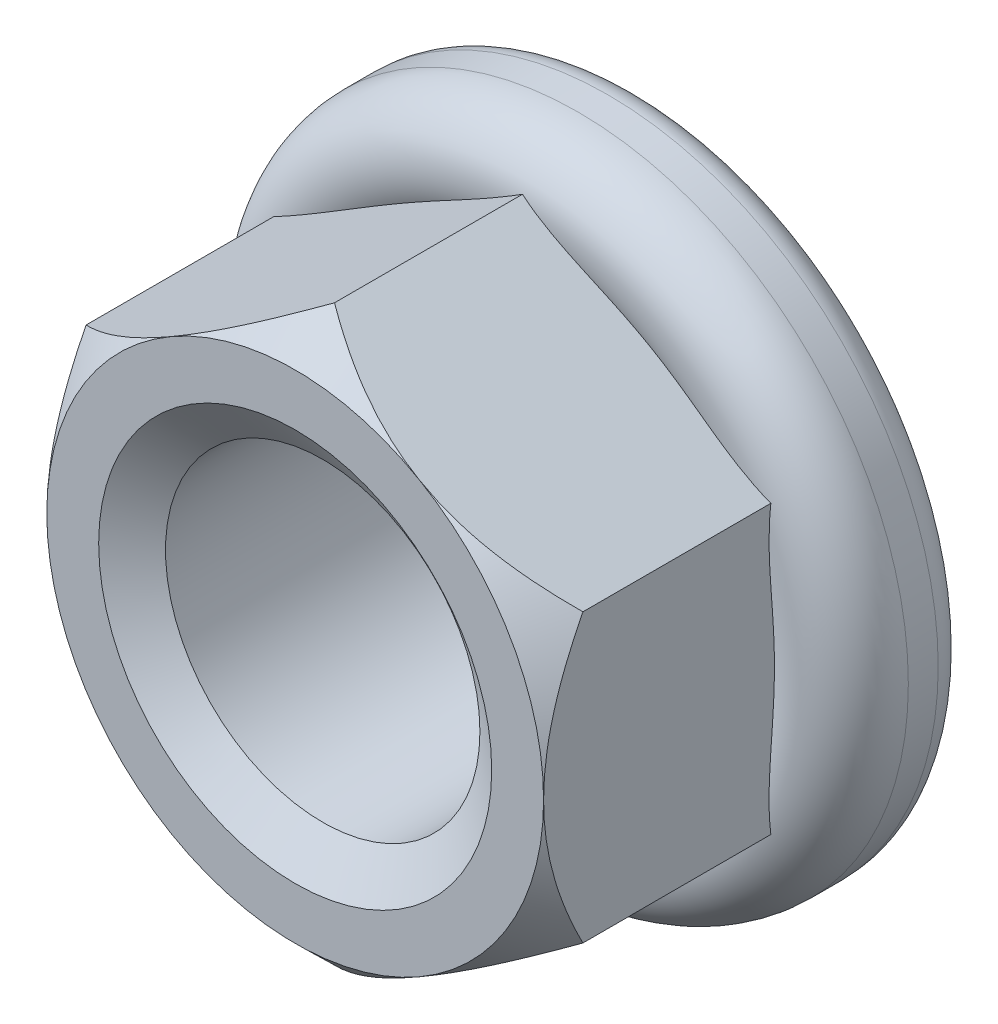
SolidWorks part; units mm, degrees
ref_plane "Plane1" through (0, 0, 0) normal (0, 0, 1) x (1, 0, 0)
ref_plane "Plane2" through (0, 0, 0) normal (0, 1, 0) x (1, 0, 0)
ref_plane "Plane3" through (0, 0, 0) normal (1, 0, 0) x (0, 0, -1)
sketch "BaseNutSke" plane through (0, 0, 0) normal (0, 0, 1) x (1, 0, 0)
  line L6 (4.0132, 2.317) -> (4.0132, -2.317)
  line L7 (-4.0132, 2.317) -> (-4.0132, -2.317)
  line L8 (4.0132, 2.317) -> (0, 4.634)
  line L9 (0, 4.634) -> (-4.0132, 2.317)
  line L10 (-4.0132, -2.317) -> (0, -4.634)
  line L11 (0, -4.634) -> (4.0132, -2.317)
  circle A0 centre (0, 0) radius 2.54
  dimension "D4" = 4.0132
  dimension "Thread_min" = 5.08
  dimension "D1" = 120
  dimension "D2" = 4.0132
  dimension "D3" = 4.0132
  dimension "Width_flats" = 8.0264
extrude "BaseNut" add sketch "BaseNutSke" against normal blind 5.5626
sketch "Sketch4" plane through (0, 0, 0) normal (1, 0, 0) x (0, 0, -1)
  line L0 (5.5626, 4.0132) -> (5.1562, 4.0132)
  line L1 (5.5626, 4.0132) -> (5.5626, 17.334)
  line L2 (5.1562, 17.334) -> (5.5626, 17.334)
  line L3 (5.1562, 17.334) -> (5.1562, 4.0132)
  line L4 (0, 0) -> (34.925, 0) construction
  line L6 (5.5626, 2.317) -> (5.5626, 4.634) construction
  line L7 (0, 4.0132) -> (-12.7, 4.0132)
  line L8 (0, 2.317) -> (0, 4.634) construction
  line L9 (0.635, 4.634) -> (0.635, 17.334)
  line L10 (0.635, 17.334) -> (-12.7, 17.334)
  line L11 (-12.7, 17.334) -> (-12.7, 4.0132)
  line L12 (0, 4.0132) -> (0.635, 4.634)
  line L14 (0, 2.317) -> (0, -2.317) construction
  line L15 (5.5626, 4.634) -> (0, 4.634) construction
  dimension "D1" = 4.0132
  dimension "D2" = 0.635
  dimension "Bearing_ht" = 0.4064
  dimension "D3" = 12.7
  dimension "D4" = 12.7
revolve "Bearing-Face" [suppressed] cut sketch "Sketch4" angle 360 about L4
sketch "Sketch3" plane through (0, 0, 0) normal (1, 0, 0) x (0, 0, -1)
  line L0 (5.5626, 4.0132) -> (4.9276, 4.634) construction
  line L1 (4.9276, 4.634) -> (4.9276, 17.334) construction
  line L2 (4.9276, 17.334) -> (18.2626, 17.334) construction
  line L3 (18.2626, 17.334) -> (18.2626, 4.0132) construction
  line L4 (18.2626, 4.0132) -> (5.5626, 4.0132) construction
  line L5 (5.5626, 2.317) -> (5.5626, 4.634) construction
  line L6 (5.5626, 4.634) -> (0, 4.634) construction
  line L7 (0, 0) -> (38.6776, 0) construction
  line L8 (5.5626, 0) -> (0, 0) construction
  line L9 (2.7813, 4.634) -> (2.7813, 44.222) construction
  line L10 (0.635, 17.334) -> (-12.7, 17.334)
  line L11 (-12.7, 17.334) -> (-12.7, 4.0132)
  line L12 (-12.7, 4.0132) -> (0, 4.0132)
  line L13 (0, 4.0132) -> (0.635, 4.634)
  line L14 (0.635, 4.634) -> (0.635, 17.334)
  line L16 (5.5626, 4.634) -> (0, 4.634) construction
  dimension "D1" = 4.0132
  dimension "D2" = 0.635
  dimension "D3" = 12.7
  dimension "D4" = 12.7
revolve "Double-Chamfer" cut sketch "Sketch3" angle 360 about L7
sketch "EndChamferSke" plane through (0, 0, 0) normal (1, 0, 0) x (0, 0, -1)
  line L0 (5.5372, 3.175) -> (5.0481, 2.4765)
  line L1 (5.588, 3.175) -> (5.5372, 3.175)
  line L2 (5.588, 3.175) -> (5.588, 2.4765)
  line L3 (5.588, 2.4765) -> (5.0481, 2.4765)
  line L6 (-0.0508, 3.175) -> (0, 3.175)
  line L7 (0, 3.175) -> (0.4891, 2.4765)
  line L9 (0.4891, 2.4765) -> (-0.0508, 2.4765)
  line L10 (-0.0508, 2.4765) -> (-0.0508, 3.175)
  line L11 (25.0375, 0) -> (38.388, 0) construction
  dimension "D1" = 35
  dimension "D2" = 0.0508
  dimension "Offset1" = 5.588
  dimension "ThreadMajor" = 3.175
  dimension "ChamferDepth" = 0.6985
  dimension "Offset2" = 5.6388
sketch "ThdSchSke" plane through (0, 0, 0) normal (0, 1, 0) x (1, 0, 0)
  line L0 (-3.175, 0.0254) -> (-2.54, 0.47)
  line L1 (-2.54, 0.47) -> (-1.27, 0.47)
  line L2 (-1.27, 0.47) -> (-1.27, -0.4192)
  line L3 (-1.27, -0.4192) -> (-2.54, -0.4192)
  line L4 (-2.54, -0.4192) -> (-3.175, 0.0254)
  line L6 (0, 0.4788) -> (0, -2.9874) construction
  line L7 (3.175, 0.4788) -> (15.875, 0.4788) construction
  dimension "D1" = 0.0254
  dimension "VeeAngle" = 70
  dimension "SideAngle" = 55
  dimension "OverCut" = 2.54
  dimension "Advance" = 0.9068
  dimension "Thread_major" = 6.35
  dimension "Tap_drill" = 5.08
revolve "EndChamfer" cut sketch "EndChamferSke" angle 360 about L11
revolve "ThreadSchematic" [suppressed] cut sketch "ThdSchSke" angle 360 about L6
pattern_linear "ThdSchPat" [suppressed]
sketch "Sketch5" plane through (0, 0, 0) normal (1, 0, 0) x (0, 0, -1)
  line L0 (5.5626, 3.4755) -> (5.5626, 4.826)
  line L1 (5.0546, 5.334) -> (4.572, 5.334)
  line L2 (4.572, 3.4755) -> (5.5626, 3.4755)
  line L3 (-4.4998, 0) -> (10.8386, 0) construction
  line L4 (5.5626, 4.634) -> (5.5626, 2.317) construction
  line L8 (5.5626, 2.317) -> (5.5626, 4.634) construction
  arc A0 (4.572, 5.334) -> (4.572, 3.4755) centre (4.572, 4.4048) ccw
  arc A1 (5.5626, 4.826) -> (5.0546, 5.334) centre (5.0546, 4.826) ccw
  dimension "A_dia" = 10.668
  dimension "B_dia" = 9.652
  dimension "J" = 0.4826
revolve "Revolve1" add sketch "Sketch5" angle 360 about L3
equation "\"D2@BaseNutSke\" = \"Width_flats@BaseNutSke\" / 2"
equation "\"D3@BaseNutSke\" = \"Width_flats@BaseNutSke\" / 2"
equation "\"D1@Sketch3\" = \"Width_flats@BaseNutSke\" /2"
equation "\"D2@Sketch3\" = \"Thread_major@ThreadCosmetic\" *.1"
equation "\"D1@Sketch4\" = \"D2@BaseNutSke\""
equation "\"D2@Sketch4\" = \"Thread_major@ThreadCosmetic\" *.10"
equation "\"D4@BaseNutSke\" = \"D3@BaseNutSke\""
equation "\"Thread_major@ThdSchSke\" = \"Thread_major@ThreadCosmetic\""
equation "\"Tap_drill@ThdSchSke\" = \"Thread_min@BaseNutSke\""
equation "\"Overcut@ThdSchSke\" = \"Tap_drill@ThdSchSke\" * 0.5"
equation "\"Num_threads@ThdSchPat\" = int(  ( \"Thickness@BaseNut\" - 0.002 ) / \"Advance@ThdSchSke\" + 0.999 )  + 1"
equation "\"Advance@ThdSchPat\" = ( \"Thickness@BaseNut\" - 0.002 ) /  (\"Num_threads@ThdSchPat\" - 1) 'relax it"
equation "' \"Num_threads@ThdSchPat\" = \"Num_threads@ThdSchPat\" - sgn( \"Num_threads@ThdSchPat\" - 1) '---chamfered tips only---"
equation "\"ThreadMajor@EndChamferSke\" = \"Thread_major@ThreadCosmetic\" * 0.5"
equation "\"ChamferDepth@EndChamferSke\" = (\"Thread_major@ThreadCosmetic\" - \"Thread_min@BaseNutSke\") * 0.55"
equation "\"Offset1@EndChamferSke\" = \"Thickness@BaseNut\" + 0.001"
equation "\"Offset2@EndChamferSke\" = \"Offset1@EndChamferSke\" + 0.002"
